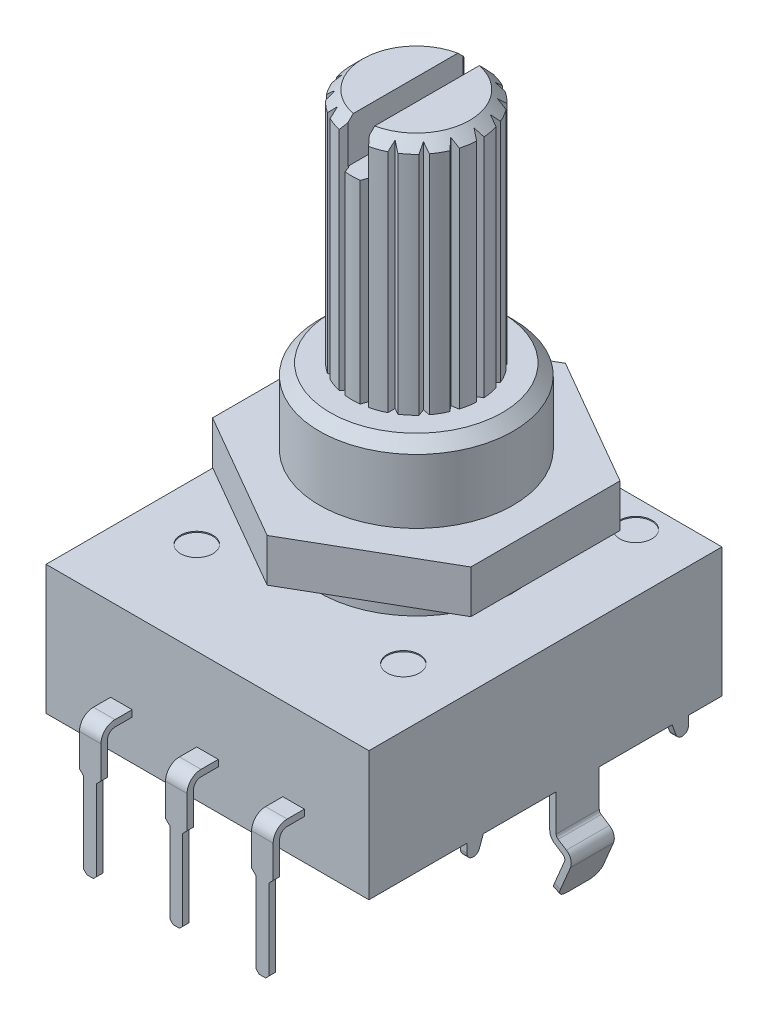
SolidWorks part; units mm, degrees
ref_plane "Front" through (0, 0, 0) normal (0, 0, 1) x (1, 0, 0)
ref_plane "Top" through (0, 0, 0) normal (0, 1, 0) x (1, 0, 0)
ref_plane "Right" through (0, 0, 0) normal (1, 0, 0) x (0, 0, -1)
sketch "Sketch1" plane through (0, 0, 0) normal (0, 1, 0) x (1, 0, 0)
  line L0 (-9.02, 0) -> (9.02, 0) construction
  line L1 (-7.5, -9.7) -> (7.5, -9.7)
  line L2 (-7.5, -9.7) -> (-7.5, 6.7)
  line L3 (-7.5, 6.7) -> (7.5, 6.7)
  line L4 (7.5, -9.7) -> (7.5, 6.7)
  line L5 (0, 0) -> (0, 6.7) construction
  dimension "D1" = 6.7
  dimension "D2" = 9.7
  dimension "D3" = 15
extrude "body" add sketch "Sketch1" against normal blind 6
sketch "Sketch2" plane through (7.5, 0, 0) normal (1, 0, 0) x (0, 0, -1)
  line L0 (0, 0) -> (0, -10.124) construction
  line L1 (0, 9.02) -> (0, -9.02) construction
  line L2 (-5.15, -6) -> (-5.15, -6.4)
  line L3 (-9.7, -6) -> (6.7, -6) construction
  line L4 (5.15, -6) -> (5.15, -6.4)
  line L5 (-4.5681, -6.5026) -> (-4.3852, -6)
  line L6 (4.5681, -6.5026) -> (4.3852, -6)
  line L7 (-5.15, -6) -> (-4.3852, -6)
  line L8 (5.15, -6) -> (4.3852, -6)
  line L9 (9.02, 0) -> (-9.02, 0) construction
  line L10 (-4.85, -6.4) -> (-4.85, -6.7) construction
  line L11 (4.85, -6.4) -> (4.85, -6.7) construction
  arc A0 (-5.15, -6.4) -> (-4.5681, -6.5026) centre (-4.85, -6.4) ccw
  arc A1 (5.15, -6.4) -> (4.5681, -6.5026) centre (4.85, -6.4) cw
  dimension "D3" = 0.3
  dimension "D1" = 10.3
  dimension "D2" = 6.7
  dimension "D4" = 20
extrude "pcb spacers" add sketch "Sketch2" against normal blind 0.3
ref_plane "PCB Surface" through (0, -6.7, 0) normal (0, 1, 0) x (-1, 0, 0)
sketch "PCB sketch" plane through (0, -6.7, 0) normal (0, 1, 0) x (-1, 0, 0)
  line L0 (0, 0) -> (0, 11) construction
  line L1 (-7.5, 1.05) -> (-7.5, -1.05)
  line L2 (7.5, 1.05) -> (5.9, 1.05)
  line L3 (7.5, 1.05) -> (7.5, -1.05)
  line L4 (7.5, -1.05) -> (5.9, -1.05)
  line L5 (5.9, 1.05) -> (5.9, -1.05)
  line L6 (-7.5, 1.05) -> (-5.9, 1.05)
  line L7 (-5.9, 1.05) -> (-5.9, -1.05)
  line L8 (-7.5, -1.05) -> (-5.9, -1.05)
  line L9 (0, 0) -> (7.5, 0) construction
  line L10 (0, 0) -> (-7.5, 0) construction
  line L11 (6.7, 1.05) -> (6.7, -1.05) construction
  line L12 (-6.7, 1.05) -> (-6.7, -1.05) construction
  circle A0 centre (0, 0) radius 1.5
  circle A1 centre (4, 11) radius 0.5
  circle A2 centre (0, 11) radius 0.5
  circle A3 centre (-4, 11) radius 0.5
  dimension "D1" = 1
  dimension "D4" = 3
  dimension "D2" = 2.1
  dimension "D3" = 1.6
  dimension "D5" = 13.4
  dimension "D6" = 11
  dimension "D7" = 8
sketch "Sketch3" plane through (0, 0, 0) normal (0, 0, 1) x (1, 0, 0)
  line L0 (7.5, -6) -> (7.5, -7.7032)
  line L1 (7.5916, -7.8712) -> (7.9711, -8.1161)
  line L2 (8.1608, -8.7302) -> (7.5, -10.3)
  line L4 (7.2, -6.7) -> (7.5, -6.7) construction
  line L5 (7.2, -6) -> (7.2, -7.7032)
  line L6 (7.4289, -8.1233) -> (7.8084, -8.3682)
  line L7 (7.8843, -8.6138) -> (7.2235, -10.1836)
  line L8 (7.2235, -10.1836) -> (7.5, -10.3)
  line L9 (7.2, -6) -> (7.5, -6)
  arc A0 (7.5, -7.7032) -> (7.5916, -7.8712) centre (7.7, -7.7032) ccw
  arc A1 (8.1608, -8.7302) -> (7.9711, -8.1161) centre (7.7, -8.5362) ccw
  arc A2 (7.2, -7.7032) -> (7.4289, -8.1233) centre (7.7, -7.7032) ccw
  arc A3 (7.8843, -8.6138) -> (7.8084, -8.3682) centre (7.7, -8.5362) ccw
  dimension "D2" = 0.2
  dimension "D3" = 0.5
  dimension "D1" = 3.6
  dimension "D4" = 100
  dimension "D5" = 0.7
  dimension "D6" = 0.3
extrude "right pcb tang" add sketch "Sketch3" along normal mid plane 2
fillet "Fillet1" radius 0.5 2 edges at (7.3618, -10.2418, -1) (7.3618, -10.2418, 1)
mirror "left pcb tang" about plane through (0, 0, 0) normal (1, 0, 0) of "Fillet1", "right pcb tang", "pcb spacers"
sketch "Sketch4" plane through (0, 0, 0) normal (0, 1, 0) x (1, 0, 0)
  line L0 (0, 0) -> (0, 5.5558) construction
  line L1 (0, -9.8175) -> (0, 9.8175) construction
  line L2 (0, 0) -> (5.8963, 0) construction
  line L3 (-9.02, 0) -> (9.02, 0) construction
  circle A0 centre (-4.8, 5.4) radius 0.75
  circle A1 centre (4.8, 5.4) radius 0.75
  circle A2 centre (4.8, -5.4) radius 0.75
  circle A3 centre (-4.8, -5.4) radius 0.75
  dimension "D2" = 10.8
  dimension "D3" = 1.5
  dimension "D1" = 9.6
extrude "dimples" cut sketch "Sketch4" against normal blind 0.05
sketch "Sketch5" plane through (0, 0, 0) normal (1, 0, 0) x (0, 0, -1)
  line L0 (-9.7, -4) -> (-10.5, -4)
  line L1 (-9.7, -6) -> (-9.7, 0) construction
  line L2 (-11, -4.5) -> (-11, -10.0954)
  line L3 (0, 9.02) -> (0, -9.02) construction
  line L4 (-9.7, -6) -> (-5.15, -6) construction
  arc A1 (-5.15, -6.4) -> (-4.5681, -6.5026) centre (-4.85, -6.4) ccw construction
  arc A2 (-11, -4.5) -> (-10.5, -4) centre (-10.5, -4.5) cw
  point P8 (-4.9021, -6.6954)
  dimension "D1" = 3.4
  dimension "D4" = 0.5
  dimension "D2" = 11
  dimension "D3" = 2
extrude "contacts" add sketch "Sketch5" along normal mid plane 9 thin
sketch "Sketch6" plane through (0, 0, 11.15) normal (0, 0, 1) x (1, 0, 0)
  line L0 (0, 0) -> (0, -10.9402) construction
  line L1 (0, -9.8175) -> (0, 9.8175) construction
  line L2 (-4.5, -6) -> (-4.3, -6.2)
  line L3 (-4.5, -6) -> (-4.5, -10.0954)
  line L4 (-4.5, -10.0954) -> (-4.3, -10.0954)
  line L5 (-4.5, -4.5) -> (-4.5, -10.0954) construction
  line L6 (-7.5, -6) -> (7.5, -6) construction
  line L7 (4.5, -6) -> (4.3, -6.2)
  line L8 (-4.3, -6.2) -> (-4.3, -10.0954)
  line L9 (4.5, -10.0954) -> (-4.5, -10.0954) construction
  line L10 (4.3, -6.2) -> (4.3, -10.0954)
  line L11 (-3.7, -10.0954) -> (-3.7, -6.2)
  line L12 (3.7, -10.0954) -> (3.7, -6.2)
  line L13 (-3.7, -6.2) -> (-3.5, -6)
  line L14 (3.7, -6.2) -> (3.5, -6)
  line L15 (-0.5, -6) -> (-0.3, -6.2)
  line L16 (0.5, -6) -> (0.3, -6.2)
  line L17 (-0.3, -6.2) -> (-0.3, -10.0954)
  line L18 (0.3, -6.2) -> (0.3, -10.0954)
  line L19 (-3.7, -10.0954) -> (-0.3, -10.0954)
  line L20 (0.3, -10.0954) -> (3.7, -10.0954)
  line L21 (4.5, -6) -> (4.5, -10.0954)
  line L22 (-3.5, -6) -> (-3.5, -3.85)
  line L23 (4.5, -3.85) -> (-4.5, -3.85) construction
  line L24 (-4, -10.0954) -> (-4, -6.5934) construction
  line L25 (4, -10.0954) -> (4, -6.5934) construction
  line L26 (3.5, -6) -> (3.5, -3.85)
  line L27 (-0.5, -6) -> (-0.5, -3.85)
  line L28 (0.5, -6) -> (0.5, -3.85)
  line L29 (-3.5, -3.85) -> (-0.5, -3.85)
  line L30 (3.5, -3.85) -> (0.5, -3.85)
  line L31 (4.3, -10.0954) -> (4.5, -10.0954)
  dimension "D1" = 0.6
  dimension "D2" = 8
  dimension "D3" = 1
  dimension "D4" = 0.6
extrude "Cut-Extrude2" cut sketch "Sketch6" against normal up to surface (1.45 mm away)
chamfer "Chamfer1" distance 0.15 angle 45 6 edges at (4.3, -10.0954, 11) (3.7, -10.0954, 11) (0.3, -10.0954, 11) (-0.3, -10.0954, 11) (-3.7, -10.0954, 11) (-4.3, -10.0954, 11)
sketch "Sketch7" plane through (0, 0, 0) normal (0, 0, 1) x (1, 0, 0)
  line L0 (0, 0) -> (0, 18.6617) construction
  line L1 (-4.5, 0) -> (-4.5, 6.5)
  line L2 (-7.5, 0) -> (7.5, 0) construction
  line L3 (-4, 7) -> (-2.98, 7)
  line L4 (-2.98, 7) -> (-2.98, 17.5)
  line L5 (-2.98, 17.5) -> (-2.48, 18)
  line L6 (-2.48, 18) -> (0, 18)
  line L7 (0, 18) -> (0, 0)
  line L8 (0, 0) -> (-4.5, 0)
  line L9 (-4, 7) -> (-4.5, 6.5)
  dimension "D1" = 7
  dimension "D2" = 18
  dimension "D3" = 5.96
  dimension "D4" = 9
  dimension "D5" = 45
  dimension "D6" = 0.5
revolve "main stem" add sketch "Sketch7" angle 360 about L0
sketch "Sketch8" plane through (0, 0, 0) normal (0, 0, 1) x (1, 0, 0)
  line L0 (0, 0) -> (0, 18) construction
  line L1 (2.48, 18) -> (-2.48, 18) construction
  line L2 (-0.5, 16) -> (-0.5, 18)
  line L3 (-0.5, 16) -> (0.5, 16)
  line L4 (-0.5, 18) -> (0.5, 18)
  line L5 (0.5, 16) -> (0.5, 18)
  line L6 (-0.5, 16) -> (0.5, 18) construction
  line L7 (-0.5, 18) -> (0.5, 16) construction
  point P6 (0, 17)
  dimension "D1" = 1
  dimension "D2" = 2
extrude "screwdriver slot" cut sketch "Sketch8" against normal up to next and the other way up to next
sketch "Sketch9" plane through (0, 7, 0) normal (0, 1, 0) x (1, 0, 0)
  line L0 (2.68, 0) -> (2.9751, 0.1704)
  line L1 (2.68, 0) -> (2.9751, -0.1704)
  line L2 (2.68, 0) -> (3.094, 0) construction
  line L3 (-9.02, 0) -> (9.02, 0) construction
  arc A1 (0.5, -2.9378) -> (0.5, 2.9378) centre (0, 0) ccw construction
  circle A2 centre (0, 0) radius 2.98 construction
  arc A3 (2.9751, -0.1704) -> (2.9751, 0.1704) centre (0, 0) ccw
  dimension "D2" = 0.3
  dimension "D1" = 60
extrude "seration" cut sketch "Sketch9" along normal up to next
pattern_circular "18 cerations" count 18 over 360 about axis through (0, 0, 0) along (0, 1, 0) of "seration"
ref_plane "Nut Surface, adjust as needed" through (0, 1.524, 0) normal (0, 1, 0) x (-1, 0, 0)
sketch "Sketch10" plane through (0, 1.524, 0) normal (0, 1, 0) x (-1, 0, 0)
  line L1 (0, 6.9282) -> (-6, 3.4641)
  line L2 (-6, 3.4641) -> (-6, -3.4641)
  line L3 (-6, -3.4641) -> (0, -6.9282)
  line L4 (0, -6.9282) -> (6, -3.4641)
  line L5 (6, -3.4641) -> (6, 3.4641)
  line L6 (6, 3.4641) -> (0, 6.9282)
  circle A0 centre (0, 0) radius 6 construction
  circle A1 centre (0, 0) radius 4
  dimension "D2" = 8
  dimension "D1" = 12
extrude "nut" add sketch "Sketch10" along normal blind 2 separate body
